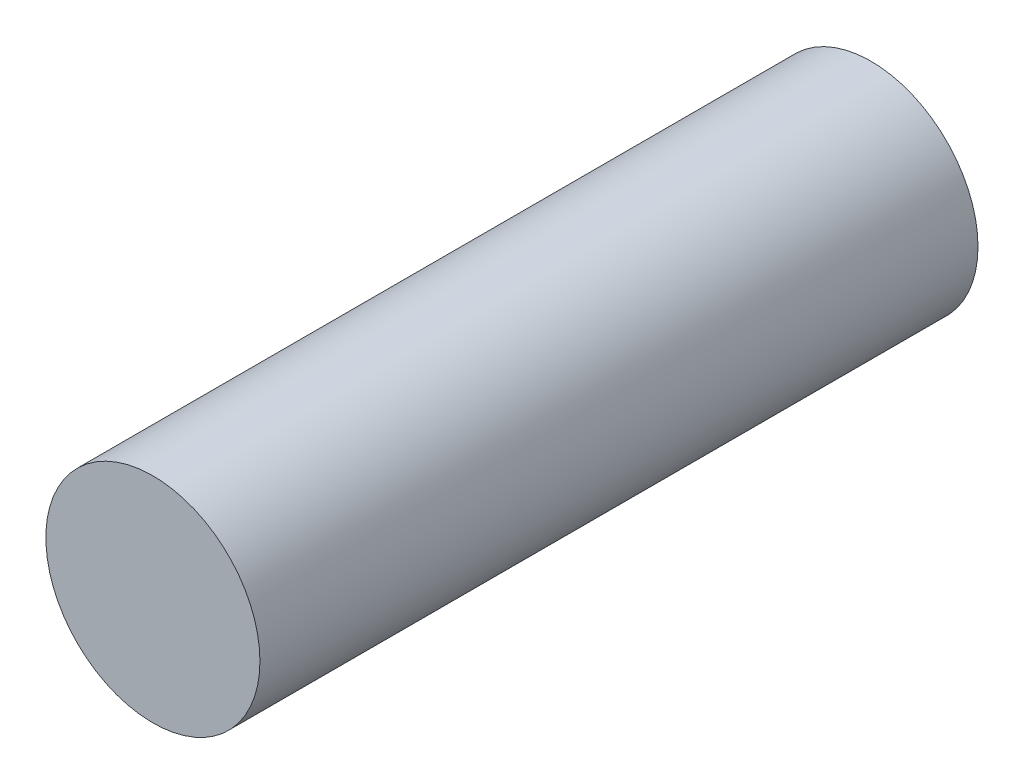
SolidWorks part; units mm, degrees
ref_plane "Front Plane" through (0, 0, 0) normal (0, 0, 1) x (1, 0, 0)
ref_plane "Top Plane" through (0, 0, 0) normal (0, 1, 0) x (1, 0, 0)
ref_plane "Right Plane" through (0, 0, 0) normal (1, 0, 0) x (0, 0, -1)
sketch "Sketch1" plane through (0, 0, 0) normal (0, 0, 1) x (1, 0, 0)
  circle A0 centre (0, 0) radius 10.45
  dimension "D1" = 20.9
extrude "Boss-Extrude1" add sketch "Sketch1" along normal blind 70.1
